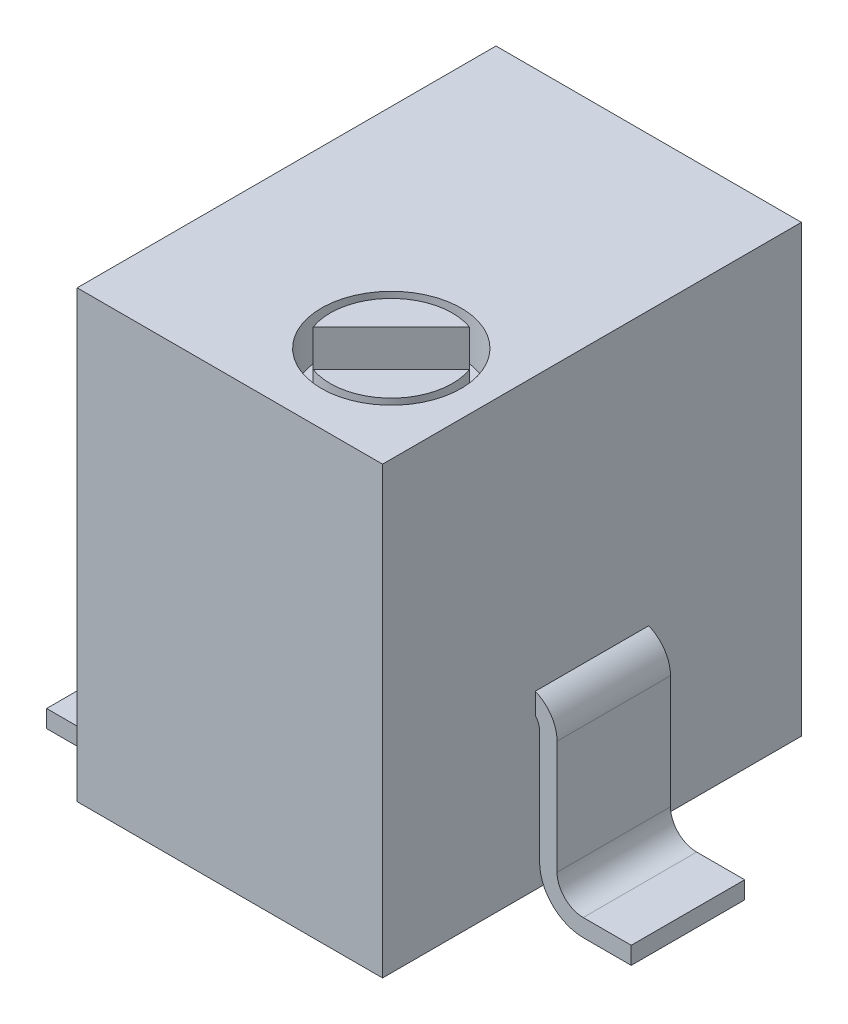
SolidWorks part; units mm, degrees
ref_plane "Front" through (0, 0, 0) normal (0, 0, 1) x (1, 0, 0)
ref_plane "Top" through (0, 0, 0) normal (0, 1, 0) x (1, 0, 0)
ref_plane "Right" through (0, 0, 0) normal (1, 0, 0) x (0, 0, -1)
sketch "Эскиз1" plane through (0, 0, 0) normal (0, 0, 1) x (1, 0, 0)
  line L0 (-2.85, 0) -> (-2.3, 0)
  line L1 (-1.8, 0.5) -> (-1.8, 1.8)
  line L2 (-1.6, 2) -> (1.6, 2)
  line L3 (1.8, 1.8) -> (1.8, 0.5)
  line L4 (2.3, 0) -> (2.85, 0)
  line L5 (0, 0) -> (0, 2) construction
  line L6 (-2.85, 0.2) -> (-2.3, 0.2)
  line L7 (-2, 0.5) -> (-2, 1.8)
  line L8 (-1.6, 2.2) -> (1.6, 2.2)
  line L9 (2, 1.8) -> (2, 0.5)
  line L10 (2.3, 0.2) -> (2.85, 0.2)
  line L11 (-2.85, 0) -> (-2.85, 0.2)
  line L12 (2.85, 0) -> (2.85, 0.2)
  arc A0 (-1.8, 1.8) -> (-1.6, 2) centre (-1.6, 1.8) cw
  arc A1 (1.6, 2) -> (1.8, 1.8) centre (1.6, 1.8) cw
  arc A2 (-2.3, 0) -> (-1.8, 0.5) centre (-2.3, 0.5) ccw
  arc A3 (1.8, 0.5) -> (2.3, 0) centre (2.3, 0.5) ccw
  arc A4 (-2.3, 0.2) -> (-2, 0.5) centre (-2.3, 0.5) ccw
  arc A5 (-2, 1.8) -> (-1.6, 2.2) centre (-1.6, 1.8) cw
  arc A6 (1.6, 2.2) -> (2, 1.8) centre (1.6, 1.8) cw
  arc A7 (2, 0.5) -> (2.3, 0.2) centre (2.3, 0.5) ccw
  dimension "D3" = 0.2
  dimension "D4" = 0.5
  dimension "D1" = 5.7
  dimension "D2" = 2
  dimension "D6" = 4
  dimension "D5" = 0.2
extrude "Вытянуть1" add sketch "Эскиз1" along normal mid plane 3.3
sketch "Эскиз2" plane through (0, 0, 0) normal (0, 1, 0) x (1, 0, 0)
  line L0 (0, -2.4) -> (0, 2.4) construction
  line L1 (-1.75, -2.4) -> (1.75, -2.4)
  line L2 (-1.75, -2.4) -> (-1.75, 2.4)
  line L3 (-1.75, 2.4) -> (1.75, 2.4)
  line L4 (1.75, -2.4) -> (1.75, 2.4)
  dimension "D1" = 3.5
  dimension "D2" = 4.8
extrude "Вытянуть2" add sketch "Эскиз2" along normal blind 5.1 from offset 0.2
sketch "Эскиз3" plane through (0, 0, 0) normal (0, 1, 0) x (1, 0, 0)
  line L0 (-2.85, -1.65) -> (-2.85, 1.65) construction
  line L1 (-2.85, 0.85) -> (-1.75, 0.85)
  line L2 (-2.85, 0.85) -> (-2.85, -0.85)
  line L3 (-2.85, -0.85) -> (-1.75, -0.85)
  line L4 (-1.75, 0.85) -> (-1.75, -0.85)
  line L5 (-1.75, 2.4) -> (-1.75, -2.4) construction
  line L6 (1.75, -1.65) -> (1.75, 1.65) construction
  line L7 (2.85, 1.65) -> (1.75, 1.65)
  line L8 (2.85, 1.65) -> (2.85, 0.65)
  line L9 (2.85, 0.65) -> (1.75, 0.65)
  line L10 (1.75, 1.65) -> (1.75, 0.65)
  line L11 (2.85, 0) -> (-2.85, 0) construction
  line L12 (2.85, -1.65) -> (1.75, -1.65)
  line L13 (2.85, -1.65) -> (2.85, -0.65)
  line L14 (2.85, -0.65) -> (1.75, -0.65)
  line L15 (1.75, -1.65) -> (1.75, -0.65)
  line L16 (2.85, -1.65) -> (2.85, 1.65) construction
  line L17 (-2.3, 1.65) -> (-2.85, 1.65) construction
  dimension "D1" = 1.3
  dimension "D2" = 0.8
extrude "Вырез-Вытянуть1" cut sketch "Эскиз3" along normal through all
sketch "Эскиз4" plane through (0, 5.3, 0) normal (0, 1, 0) x (-1, 0, 0)
  line L0 (0.0093, 1.4351) -> (-0.8851, 0.5407)
  line L1 (-0.4149, 1.8593) -> (-1.3093, 0.9649)
  line L2 (-0.155, 1.695) -> (-1.145, 0.705) construction
  line L3 (1.75, 2.4) -> (-1.75, 2.4) construction
  line L4 (1.75, -2.4) -> (1.75, 2.4) construction
  circle A0 centre (-0.65, 1.2) radius 0.8
  arc A1 (-0.8851, 0.5407) -> (0.0093, 1.4351) centre (-0.65, 1.2) ccw
  arc A2 (-0.4149, 1.8593) -> (-1.3093, 0.9649) centre (-0.65, 1.2) ccw
  dimension "D4" = 0.7
  dimension "D5" = 1.6
  dimension "D1" = 45
  dimension "D2" = 1.2
  dimension "D3" = 2.4
  dimension "D6" = 0.6
extrude "Вырез-Вытянуть2" cut sketch "Эскиз4" against normal blind 0.5
